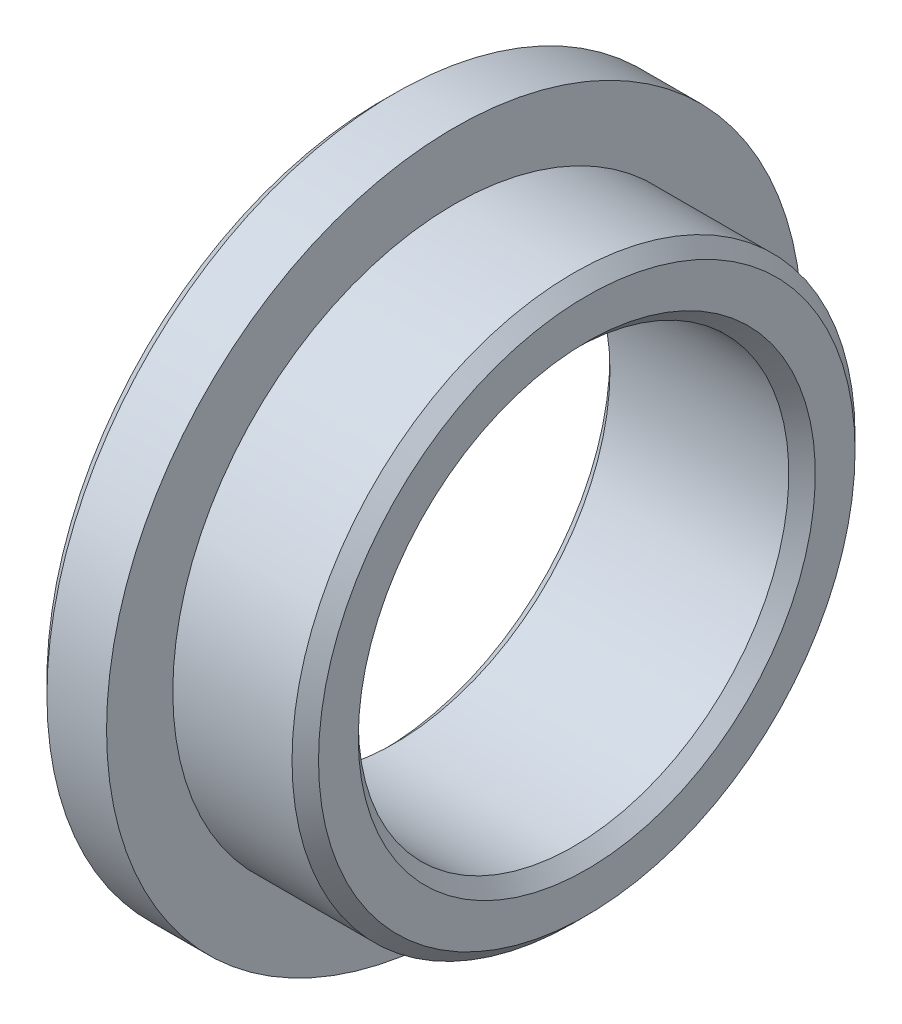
SolidWorks part; units mm, degrees
ref_plane "Plan1" through (0, 0, 0) normal (0, 0, 1) x (1, 0, 0)
ref_plane "Plan2" through (0, 0, 0) normal (0, 1, 0) x (1, 0, 0)
ref_plane "Plan3" through (0, 0, 0) normal (1, 0, 0) x (0, 0, -1)
sketch "Esquisse1" plane through (0, 0, 0) normal (0, 0, 1) x (1, 0, 0)
  line L0 (-17.7397, 0) -> (28.827, 0) construction
  line L1 (-11, 52.5) -> (0, 52.5)
  line L2 (0, 42.5) -> (20, 42.5)
  line L3 (-11, 52.5) -> (-11, 32.5)
  line L4 (20, 42.5) -> (20, 32.5)
  line L5 (-11, 32.5) -> (20, 32.5)
  line L6 (0, 42.5) -> (0, 52.5)
  dimension "D1" = 20
  dimension "D2" = 31
  dimension "D3" = 32.5
  dimension "D4" = 42.5
  dimension "D5" = 52.5
  dimension "D6" = 11
revolve "Base-Révolution" add sketch "Esquisse1" angle 360 about L0
chamfer "Chanfrein1" distance 2 angle 45
